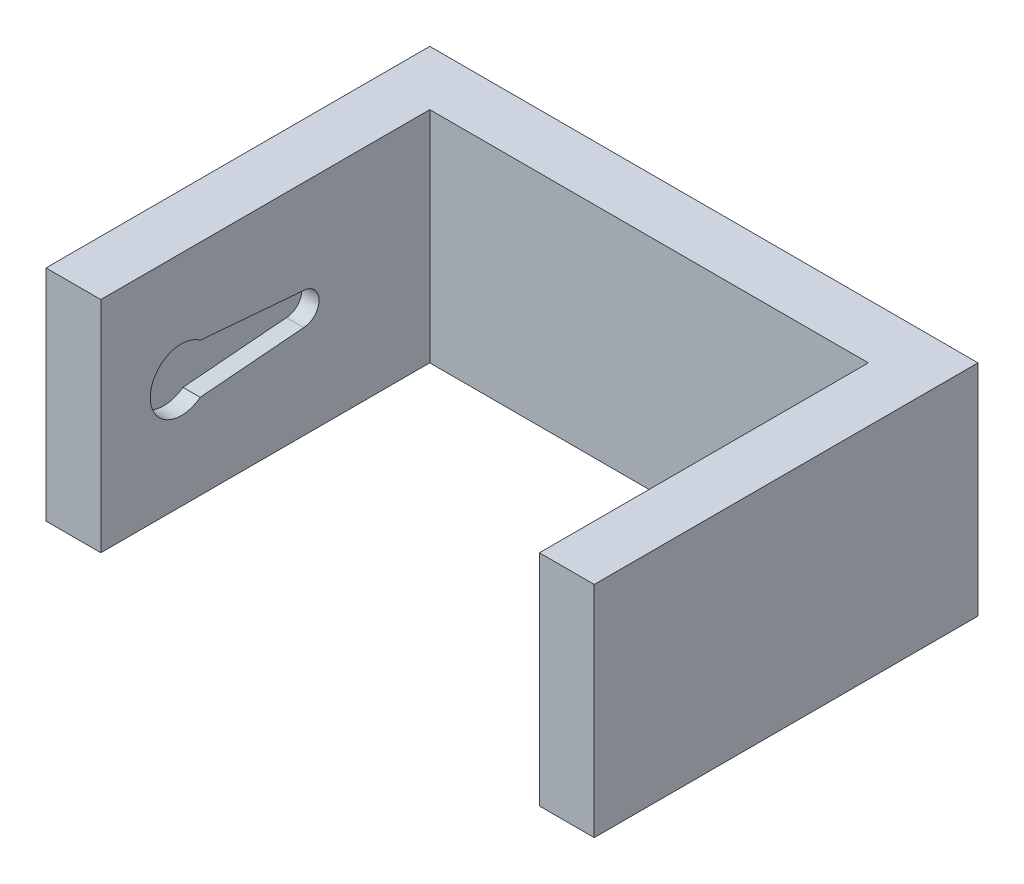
SolidWorks part; units mm, degrees
ref_plane "Front Plane" through (0, 0, 0) normal (0, 0, 1) x (1, 0, 0)
ref_plane "Top Plane" through (0, 0, 0) normal (0, 1, 0) x (1, 0, 0)
ref_plane "Right Plane" through (0, 0, 0) normal (1, 0, 0) x (0, 0, -1)
imported_body "pusher-1-solid1"
sketch "Sketch1" plane through (-46.8037, 0, 0) normal (1, 0, 0) x (0, 0, -1)
  line L2 (-28.2901, -6.3864) -> (-16.2978, -7.3833)
  line L3 (-28.2901, -12.106) -> (-16.2978, -11.109)
  arc A0 (-28.2901, -6.3864) -> (-28.2901, -12.106) centre (-30.4767, -9.2462) ccw
  arc A1 (-16.2978, -7.3833) -> (-16.2978, -11.109) centre (-16.3874, -9.2462) cw
extrude "Cut-Extrude2" cut sketch "Sketch1" against normal blind 2
